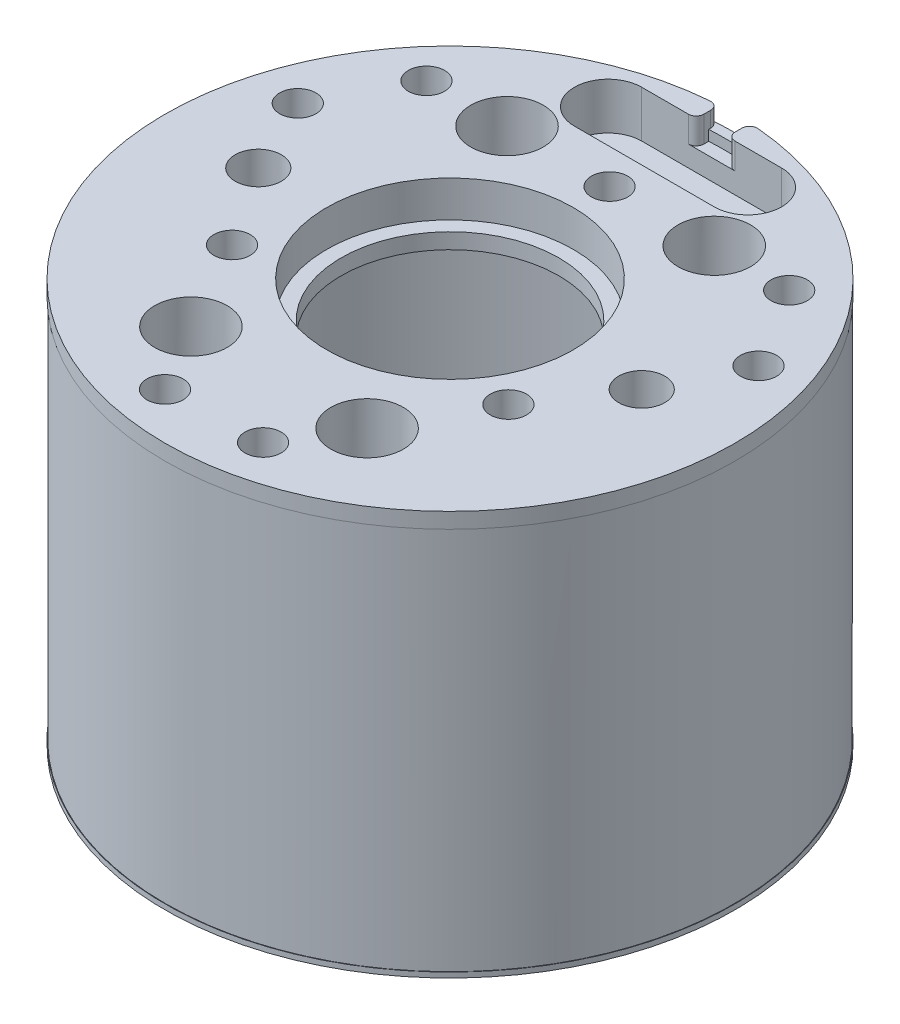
SolidWorks part; units mm, degrees
ref_plane "Front Plane" through (0, 0, 0) normal (0, 0, 1) x (1, 0, 0)
ref_plane "Top Plane" through (0, 0, 0) normal (0, 1, 0) x (1, 0, 0)
ref_plane "Right Plane" through (0, 0, 0) normal (1, 0, 0) x (0, 0, -1)
sketch "Sketch1" plane through (0, 0, 0) normal (0, 0, 1) x (1, 0, 0)
  line L0 (5.334, 18.034) -> (5.334, 17.272)
  line L1 (5.334, 17.272) -> (13.208, 17.272)
  line L2 (13.208, 17.272) -> (13.208, 0)
  line L3 (13.208, 0) -> (13.97, 0)
  line L4 (13.97, 0) -> (13.97, 0.254)
  line L5 (13.97, 0.254) -> (13.462, 0.254)
  line L6 (13.462, 0.254) -> (13.462, 19.05)
  line L7 (13.462, 19.05) -> (13.97, 19.05)
  line L8 (13.97, 19.05) -> (13.97, 19.812)
  line L9 (13.97, 19.812) -> (6.0452, 19.812)
  line L10 (6.0452, 19.812) -> (6.0452, 18.034)
  line L11 (6.0452, 18.034) -> (5.334, 18.034)
  line L12 (0, 0) -> (0, 22.0667) construction
  dimension "D1" = 19.558
  dimension "D2" = 10.668
  dimension "D3" = 12.0904
  dimension "D4" = 1.778
  dimension "D5" = 2.54
  dimension "D6" = 27.94
  dimension "D7" = 0.762
  dimension "D8" = 26.924
  dimension "D9" = 26.416
  dimension "D10" = 19.812
revolve "Revolve1" add sketch "Sketch1" angle 360 about L12
sketch "Sketch2" plane through (0, 19.812, 0) normal (0, 1, 0) x (1, 0, 0)
  line L0 (-13.5476, 7.8217) -> (0, -15.6435) construction
  line L1 (0, -15.6435) -> (13.5476, 7.8217) construction
  line L2 (13.5476, 7.8217) -> (-13.5476, 7.8217) construction
  line L3 (-13.5476, 7.8217) -> (0, 0) construction
  line L4 (0, 0) -> (13.5476, 7.8217) construction
  line L5 (0, 0) -> (0, -15.6435) construction
  line L6 (0, 0) -> (-6.7738, -3.9109) construction
  line L7 (-11.176, 3.7139) -> (0, 0) construction
  line L8 (0, 0) -> (-2.286, -11.684) construction
  line L9 (0, 0) -> (9.398, 0) construction
  line L10 (0, 0) -> (-9.398, 0) construction
  dimension "D1" = 2.286
  dimension "D2" = 11.684
  dimension "D3" = 11.176
  dimension "D4" = 9.398
hole_wizard "#2-56 Tapped Hole1" positions "Sketch3" profile "Sketch4" tap size "#2-56" standard "ANSI Inch"
sketch "Sketch3" plane through (0, 19.812, 0) normal (0, 1, 0) x (-1, 0, 0)
  point P0 (11.176, -3.7139)
  point P3 (6.7738, 3.9109)
  point P6 (2.286, 11.684)
sketch "Sketch4" plane through (-11.176, 19.812, -3.7139) normal (1, 0, 0) x (0, 0, 1)
  line L0 (0, 0) -> (0, 19.812)
  line L1 (0, 19.812) -> (0.889, 19.812)
  line L2 (0.889, 19.812) -> (0.889, 0)
  line L5 (0.889, 0) -> (0, 0)
  line L11 (0, -6.35) -> (0, 107.95) construction
  dimension "Thru Tap Drill Dia." = 1.778
  dimension "Thru Tap Drill Depth" = 19.812
pattern_circular "CirPattern1" count 3 over 360 about axis through (0, 0, 0) along (0, 1, 0) of "#2-56 Tapped Hole1"
hole_wizard "#4-40 Tapped Hole2" positions "Sketch7" profile "Sketch8" tap size "#4-40" standard "ANSI Inch"
sketch "Sketch7" plane through (0, 19.812, 0) normal (0, 1, 0) x (1, 0, 0)
  point P0 (-9.398, 0)
  point P3 (9.398, 0)
sketch "Sketch8" plane through (-9.398, 19.812, 0) normal (1, 0, 0) x (0, 0, 1)
  line L0 (0, 0) -> (0, 8.1722)
  line L1 (0, 8.1722) -> (1.1303, 7.493)
  line L2 (1.1303, 7.493) -> (1.1303, 0)
  line L5 (1.1303, 0) -> (0, 0)
  line L10 (0, 8.1722) -> (-1.1303, 7.493) construction
  line L11 (0, -6.35) -> (0, 107.95) construction
  dimension "Tap Drill Dia." = 2.2606
  dimension "Tap Drill Depth" = 7.493
  dimension "Drill Angle" = 118
sketch "Sketch9" plane through (0, 19.812, 0) normal (0, 1, 0) x (1, 0, 0)
  line L0 (0, 7.874) -> (-5.08, 7.874) construction
  line L1 (0, 7.874) -> (5.08, 7.874) construction
  line L2 (0, -8.382) -> (4.318, -8.382) construction
  line L3 (0, -8.382) -> (-4.318, -8.382) construction
  circle A0 centre (-4.318, -8.382) radius 1.778
  circle A1 centre (4.318, -8.382) radius 1.778
  circle A2 centre (-5.08, 7.874) radius 1.778
  circle A3 centre (5.08, 7.874) radius 1.778
  point P12 (0, 0)
  point P13 (0, 10.0729)
  point P14 (2.1919, 7.874)
  point P15 (0, 0)
  dimension "D1" = 3.556
  dimension "D2" = 5.08
  dimension "D3" = 4.318
  dimension "D4" = 8.382
  dimension "D5" = 7.874
extrude "4 Holes" cut sketch "Sketch9" against normal through all
sketch "Sketch10" plane through (0, 19.812, 0) normal (0, 1, 0) x (1, 0, 0)
  line L0 (-3.429, 11.176) -> (3.429, 11.176) construction
  line L1 (-3.429, 12.827) -> (3.429, 12.827)
  line L2 (-3.429, 9.525) -> (3.429, 9.525)
  line L3 (-3.429, 11.176) -> (-5.08, 11.176) construction
  line L4 (3.429, 11.176) -> (5.08, 11.176) construction
  arc A0 (-3.429, 12.827) -> (-3.429, 9.525) centre (-3.429, 11.176) ccw
  arc A1 (3.429, 9.525) -> (3.429, 12.827) centre (3.429, 11.176) ccw
  point P2 (0, 11.176)
  dimension "D1" = 1.651
  dimension "D2" = 10.16
  dimension "D3" = 11.176
extrude "Slot" cut sketch "Sketch10" against normal blind 2.286
sketch "Sketch11" plane through (0, 19.812, 0) normal (0, 1, 0) x (1, 0, 0)
  line L0 (3.429, 12.827) -> (-3.429, 12.827) construction
  line L1 (0.762, 12.827) -> (-0.762, 12.827)
  line L2 (0.762, 12.827) -> (0.762, 13.97)
  line L3 (0.762, 13.97) -> (-0.762, 13.97)
  line L4 (-0.762, 12.827) -> (-0.762, 13.97)
  line L5 (0.762, 12.827) -> (-0.762, 13.97) construction
  line L6 (0.762, 13.97) -> (-0.762, 12.827) construction
  circle A0 centre (0, 0) radius 13.97 construction
  point P0 (0, 13.3985)
  point P5 (0, 0)
  dimension "D1" = 1.524
extrude "Notch" cut sketch "Sketch11" against normal blind 1.27
fillet "Notch Fillet" radius 0.381 4 edges at (0.762, 19.177, -12.827) (-0.762, 19.177, -12.827) (-0.762, 19.431, -13.9492) (0.762, 19.431, -13.9492)
sketch "Sketch12" plane through (0, 0, 0) normal (0, 0, 1) x (1, 0, 0)
  line L0 (-13.462, 19.05) -> (13.462, 19.05) construction
  line L1 (13.462, 19.05) -> (13.9446, 19.05)
  line L2 (13.462, 19.05) -> (13.462, 0.254)
  line L3 (13.462, 0.254) -> (13.9446, 0.254)
  line L4 (13.9446, 19.05) -> (13.9446, 0.254)
  line L5 (-13.97, 19.05) -> (13.97, 19.05) construction
  line L6 (13.97, 0.254) -> (-13.97, 0.254) construction
  line L7 (13.462, 0.254) -> (13.462, 19.05) construction
  line L8 (13.97, 0) -> (13.97, 0.254) construction
  line L9 (0, 0) -> (0, 13.0942) construction
  dimension "D1" = 0.0254
revolve "Coils" add sketch "Sketch12" angle 360 about L9
